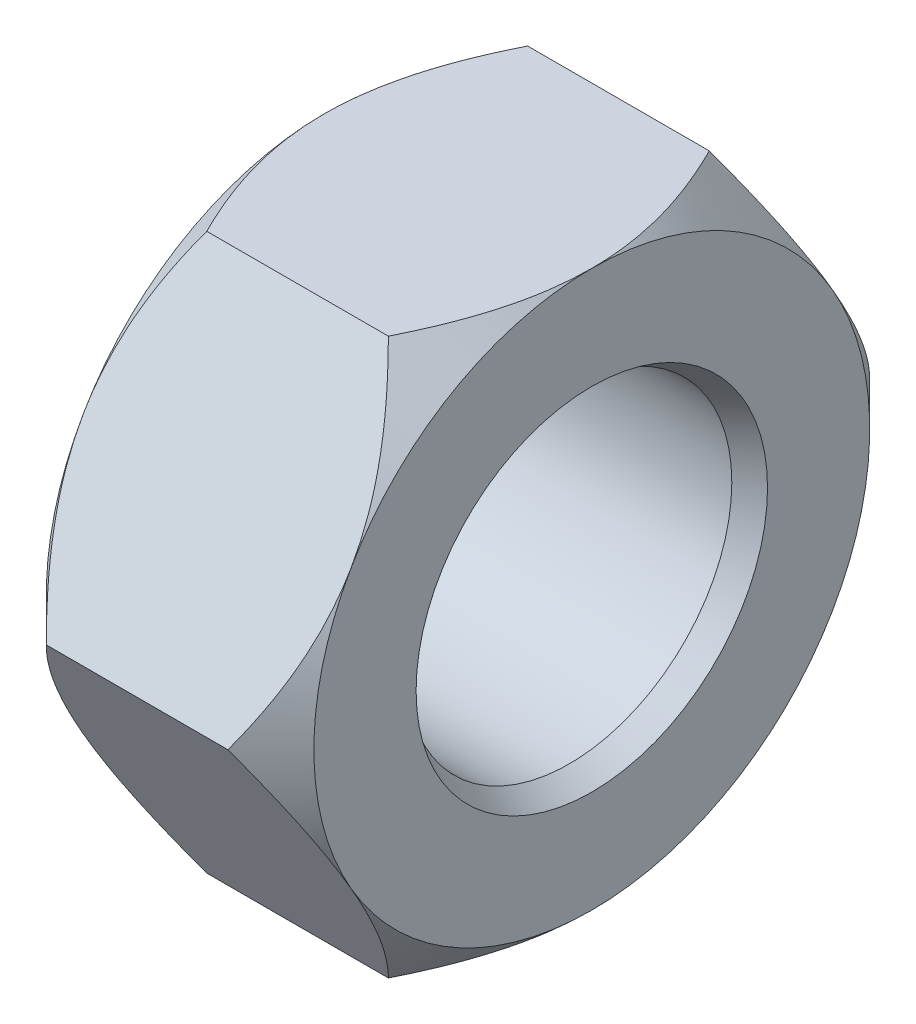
SolidWorks part; units mm, degrees
ref_plane "Plan de face" through (0, 0, 0) normal (0, 0, 1) x (1, 0, 0)
ref_plane "Plan de dessus" through (0, 0, 0) normal (0, 1, 0) x (1, 0, 0)
ref_plane "Plan de droite" through (0, 0, 0) normal (1, 0, 0) x (0, 0, -1)
sketch "Esquisse1" plane through (0, 0, 0) normal (0, 0, 1) x (1, 0, 0)
  line L0 (-26.7036, 0) -> (42.1872, 0) construction
  line L1 (0, 13.5) -> (0, 7.9)
  line L2 (0, 7.9) -> (13, 7.9)
  line L3 (13, 7.9) -> (13, 13.5)
  line L4 (13, 13.5) -> (8, 18.5)
  line L5 (8, 18.5) -> (5, 18.5)
  line L6 (5, 18.5) -> (0, 13.5)
  dimension "D1" = 15.8
  dimension "D2" = 13
  dimension "D3" = 27
  dimension "D4" = 45
  dimension "D5" = 45
  dimension "D6" = 37
revolve "Volume" add sketch "Esquisse1" angle 360 about L0
sketch "Esquisse2" plane through (0, 0, 0) normal (-1, 0, 0) x (0, 0, 1)
  line L1 (7.7942, -13.5) -> (15.5885, 0)
  line L2 (15.5885, 0) -> (7.7942, 13.5)
  line L3 (7.7942, 13.5) -> (-7.7942, 13.5)
  line L4 (-7.7942, 13.5) -> (-15.5885, 0)
  line L5 (-15.5885, 0) -> (-7.7942, -13.5)
  line L6 (-7.7942, -13.5) -> (7.7942, -13.5)
  circle A0 centre (0, 0) radius 13.5 construction
  circle A1 centre (0, 0) radius 13.5 construction
extrude "Profil hexagonal" cut sketch "Esquisse2" against normal through all flip side to cut
chamfer "Chanfrein1" distance 1.1 angle 30 2 edges at (0, 0, 7.9) (13, 0, 7.9)
